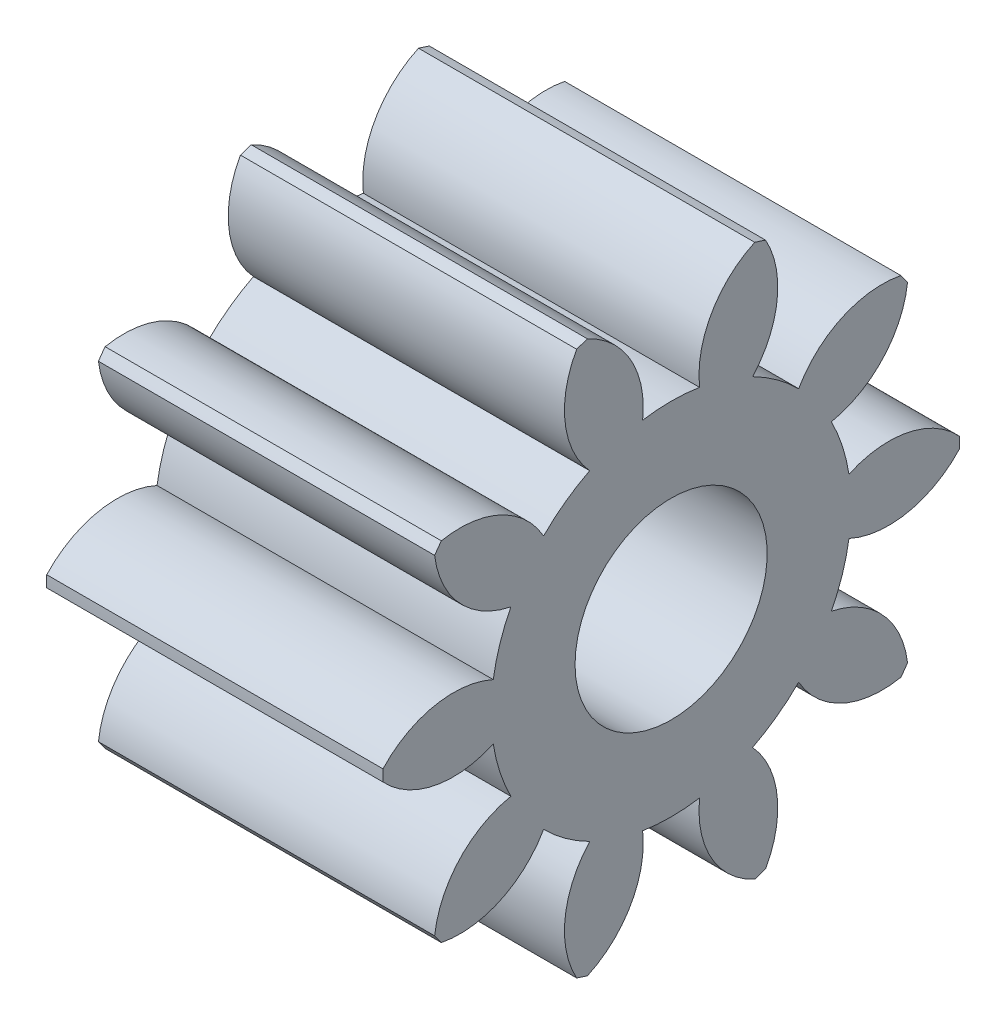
SolidWorks part; units mm, degrees
ref_plane "Plane1" through (0, 0, 0) normal (0, 0, 1) x (1, 0, 0)
ref_plane "Plane2" through (0, 0, 0) normal (0, 1, 0) x (1, 0, 0)
ref_plane "Plane3" through (0, 0, 0) normal (1, 0, 0) x (0, 0, -1)
sketch "HoldingSke" plane through (0, 0, 0) normal (0, 1, 0) x (1, 0, 0)
  line L0 (0, 0) -> (1.9696, -0.3473)
  line L1 (-15, 0) -> (100, 0) construction
  line L2 (0, 0) -> (-2.1039, 2.3779)
  line L3 (0, 0) -> (-11.863, 4.5341)
  line L4 (0, 0) -> (8.5048, 1.4996)
  line L5 (0, 0) -> (-46.8476, -17.4728)
  line L6 (0, 0) -> (-2.9014, -1.9576)
  line L7 (-2.1039, 2.3779) -> (8.6586, 51.2059)
  line L8 (-76.2, 54.61) -> (-75.9, 54.61)
  line L9 (-71.009, 38.7566) -> (-53.1078, 45.2721)
  line L10 (-76.2, 71.12) -> (104.1128, 71.12)
  line L11 (0, 0) -> (-3.5, 0)
  line L12 (-76.2, 101.6) -> (-76.181, 101.6)
  line L13 (24.9733, 27.94) -> (52.9518, 28.4284)
  line L14 (24.9733, 27.94) -> (24.9743, 27.94)
  line L15 (24.9733, 27.94) -> (100.4006, 29.5858)
  line L16 (-63.627, -0.5) -> (-12.827, -0.5)
  circle A0 centre (0, 0) radius 1
  circle A1 centre (0, 0) radius 1.874
  circle A2 centre (0, 0) radius 37.5
  circle A3 centre (0, 0) radius 1
sketch "BasProSke" plane through (0, 0, 0) normal (0, 1, 0) x (1, 0, 0)
  line L0 (-10, 0) -> (60, 0) construction
  line L1 (0, 0) -> (0, 3)
  line L2 (0, 0) -> (3.5, 0)
  line L3 (3.5, 0) -> (3.5, 3)
  line L4 (3.5, 3) -> (0, 3)
revolve "Base-Revolve" add sketch "BasProSke" angle 360 about L0
sketch "TooCutSke" plane through (0, 0, 0) normal (1, 0, 0) x (0, 0, -1)
  line L1 (0, 0) -> (0, 107) construction
  line L2 (0, 0) -> (-0.4243, 2.4637) construction
  line L3 (0, 0) -> (-1.5292, 4.7063) construction
  line L4 (-0.4243, 2.4637) -> (-0.7646, 2.3532) construction
  arc A0 (0.2964, 1.8504) -> (-0.2964, 1.8504) centre (0, 0) ccw
  arc A1 (0.9059, 2.8866) -> (-0.9059, 2.8866) centre (0, 0) ccw
  circle A2 centre (0, 0) radius 2.5 construction
  circle A3 centre (0, 0) radius 2.3492 construction
  arc A4 (-0.2964, 1.8504) -> (-0.9059, 2.8866) centre (-1.2901, 1.9633) ccw
  arc A5 (0.9059, 2.8866) -> (0.2964, 1.8504) centre (1.2901, 1.9633) ccw
extrude "ToothCut" cut sketch "TooCutSke" along normal through all
fillet "Breaks" [suppressed] radius 0.01
fillet "RootFillets" [suppressed] radius 0.126
pattern_circular "TeethCuts" count 10 every 36 about axis through (-10, 0, 0) along (1, 0, 0) of "ToothCut", "RootFillets", "Breaks"
sketch "HubNeaOneSke" plane through (0, 0, 0) normal (-1, 0, 0) x (0, 0, 1)
  circle A0 centre (0, 0) radius 1.874
extrude "HubNearOne" [suppressed] add sketch "HubNeaOneSke" along normal blind 46.5001
sketch "HubNeaBotSke" plane through (0, 0, 0) normal (-1, 0, 0) x (0, 0, 1)
  circle A0 centre (0, 0) radius 1.874
extrude "HubNearBoth" [suppressed] add sketch "HubNeaBotSke" along normal blind 23.25
ref_plane "FarPln" through (3.5, 0, 0) normal (1, 0, 0) x (0, 0, -1)
sketch "HubFarSke" plane through (3.5, 0, 0) normal (1, 0, 0) x (0, 0, -1)
  circle A0 centre (0, 0) radius 1.874
extrude "HubFar" [suppressed] add sketch "HubFarSke" along normal blind 23.25
sketch "BorSke" plane through (0, 0, 0) normal (1, 0, 0) x (0, 0, -1)
  circle A0 centre (0, 0) radius 1
extrude "Bore" cut sketch "BorSke" along normal mid plane 100.0001
sketch "KeySke" plane through (0, 0, 0) normal (1, 0, 0) x (0, 0, -1)
  line L0 (-0.4, 0) -> (-0.4, 1.3)
  line L1 (-0.4, 1.3) -> (0.4, 1.3)
  line L2 (0.4, 1.3) -> (0.4, 0)
  line L3 (0, 0) -> (0, 34) construction
  line L4 (-0.4, 0) -> (0.4, 0)
extrude "Keyway" [suppressed] cut sketch "KeySke" along normal mid plane 100.0001
pattern_circular "Keyway2" [suppressed] count 2 every 90 about axis through (-10, 0, 0) along (1, 0, 0)
equation "' \"Module@HoldingSke\" = 6.35"
equation "' \"Num_teeth@HoldingSke\" = 12"
equation "' \"Ap@HoldingSke\" =  20"
equation "' \"Ap@HoldingSke\" = 20"
equation "' \"Width@HoldingSke\" = 0.5 * 25.4"
equation "' \"Hub_dia@HoldingSke\"= 1 * 25.4"
equation "' \"Hub_dia@HoldingSke\" = 1 * 25.4"
equation "' \"Overall_len@HoldingSke\" = 1.0 * 25.4"
equation "' \"Bore@HoldingSke\" = 0.75 * 25.4"
equation "' \"T_dim@HoldingSke\" = 0.1 * 25.4"
equation "' \"Width@KeySke\" = 0.25 * 25.4"
equation "' \"Show_teeth@HoldingSke\" = 13"
equation "' \"Backlash@HoldingSke\" = 0.009 * 25.4"
equation "' \"Addendum_fac@HoldingSke\" = 1.0"
equation "' \"Dedendum_fac@HoldingSke\" = 1.25"
equation "' \"Dedendum_add@HoldingSke\" = 0.00005 * 25.4"
equation "' \"Clearance_fac@HoldingSke\" = 0.25"
equation "\"Pitch@HoldingSke\" = 1 / \"Module@HoldingSke\""
equation "\"Overcut_dia@TooCutSke\" = (\"Num_teeth@HoldingSke\" + 2 * \"Addendum_fac@HoldingSke\") / \"Pitch@HoldingSke\" + 0.002 * 25.4"
equation "\"Pitch_dia@TooCutSke\" = \"Num_teeth@HoldingSke\" / \"Pitch@HoldingSke\""
equation "\"Base_dia@TooCutSke\" = \"Num_teeth@HoldingSke\" / \"Pitch@HoldingSke\" * cos((\"Ap@HoldingSke\"  * 3.14159265 / 180))"
equation "\"Root_dia@TooCutSke\" = (\"Num_teeth@HoldingSke\" + 2) / \"Pitch@HoldingSke\" - 2 * (\"Addendum_fac@HoldingSke\" + \"Dedendum_fac@HoldingSke\") / \"Pitch@HoldingSke\" - \"Dedendum_add@HoldingSke\" * 2"
equation "\"Half_ang@TooCutSke\" = 180 / \"Num_teeth@HoldingSke\""
equation "\"Half_CT@TooCutSke\" = \"Num_teeth@HoldingSke\" / \"Pitch@HoldingSke\" * sin((3.14159265 / 2 / \"Num_teeth@HoldingSke\")) / 2 - 7 * \"Backlash@HoldingSke\" / 4"
equation "\"Flank_rad@TooCutSke\" = \"Num_teeth@HoldingSke\" / \"Pitch@HoldingSke\" / 5"
equation "\"Radius@RootFillets\" = \"Clearance_fac@HoldingSke\" / \"Pitch@HoldingSke\" + \"Dedendum_add@HoldingSke\""
equation "\"Break_rad@Breaks\" = 0.02 / \"Pitch@HoldingSke\""
equation "\"Thickness@HoldingSke\" = \"Width@HoldingSke\""
equation "\"OAL@HoldingSke\" = \"Thickness@HoldingSke\""
equation "\"MHD@HoldingSke\" = (\"Num_teeth@HoldingSke\" + 2) / \"Pitch@HoldingSke\" - 2 * (\"Addendum_fac@HoldingSke\" + \"Dedendum_fac@HoldingSke\")  / \"Pitch@HoldingSke\" - \"Dedendum_add@HoldingSke\" * 2"
equation "\"MBD@HoldingSke\" = (\"Num_teeth@HoldingSke\" + 2) / \"Pitch@HoldingSke\" - 2 * (\"Addendum_fac@HoldingSke\" + \"Dedendum_fac@HoldingSke\")  / \"Pitch@HoldingSke\" - \"Dedendum_add@HoldingSke\" * 2 - 0.002 * 25.4"
equation "\"MHD@HoldingSke\" = ((sgn( \"MHD@HoldingSke\" - \"Hub_dia@HoldingSke\" )-1)*( \"MHD@HoldingSke\" - \"Hub_dia@HoldingSke\" ))/-2+ \"Hub_dia@HoldingSke\""
equation "\"MBD@HoldingSke\" = ((sgn( \"MBD@HoldingSke\" - \"Bore@HoldingSke\" )-1)*( \"MBD@HoldingSke\" - \"Bore@HoldingSke\" ))/-2+ \"Bore@HoldingSke\""
equation "\"OAL@HoldingSke\" = ((sgn( \"OAL@HoldingSke\" - \"Overall_len@HoldingSke\" )+1)*( \"OAL@HoldingSke\" - \"Overall_len@HoldingSke\" ))/2 + \"Overall_len@HoldingSke\" + 0.000002 * 25.4"
equation "\"Num_teeth@TeethCuts\" = int( \"Show_teeth@HoldingSke\" ) + 1"
equation "\"Num_teeth@TeethCuts\" = ((sgn( \"Num_teeth@TeethCuts\" - \"Num_teeth@HoldingSke\" )-1)*( \"Num_teeth@TeethCuts\" - \"Num_teeth@HoldingSke\" ))/-2+ \"Num_teeth@HoldingSke\""
equation "\"Num_teeth@TeethCuts\" = ((sgn( \"Num_teeth@TeethCuts\" - 2.0)+1)*( \"Num_teeth@TeethCuts\" - 2.0))/2 +2.0"
equation "\"Angle@TeethCuts\" = 360.0 / \"Num_teeth@HoldingSke\""
equation "\"Diameter@BasProSke\" = (\"Num_teeth@HoldingSke\" + 2 * \"Addendum_fac@HoldingSke\") / \"Pitch@HoldingSke\""
equation "\"Thickness@BasProSke\"  = \"Thickness@HoldingSke\""
equation "' \"Fillet_rad@BasProSke\" =  \"Thickness@HoldingSke\" * 0.05"
equation "' \"Fillet_rad@BasProSke\" = \"Thickness@HoldingSke\" * 0.05"
equation "\"MHD@HoldingSke\" = ((sgn( \"MHD@HoldingSke\" - \"Root_dia@TooCutSke\" )-1)*( \"MHD@HoldingSke\" - \"Root_dia@TooCutSke\" ))/-2+ \"Root_dia@TooCutSke\""
equation "\"Diameter@HubNeaOneSke\" = \"MHD@HoldingSke\""
equation "\"Length@HubNearOne\" = \"OAL@HoldingSke\" - \"Thickness@BasProSke\""
equation "\"Diameter@HubNeaBotSke\" = \"MHD@HoldingSke\""
equation "\"Length@HubNearBoth\" = ( \"OAL@HoldingSke\" - \"Thickness@BasProSke\" ) / 2.0"
equation "\"Thickness@FarPln\" = \"Thickness@BasProSke\""
equation "\"Diameter@HubFarSke\" = \"MHD@HoldingSke\""
equation "\"Length@HubFar\" = ( \"OAL@HoldingSke\" - \"Thickness@BasProSke\" ) / 2.0"
equation "\"Diameter@BorSke\" = \"MBD@HoldingSke\""
equation "\"D1@Bore\" = \"OAL@HoldingSke\" * 2.0"
equation "\"D1@Keyway\" = \"OAL@HoldingSke\" * 2.0"
equation "\"Offset@KeySke\" = \"T_dim@HoldingSke\" + \"MBD@HoldingSke\" / 2.0"
